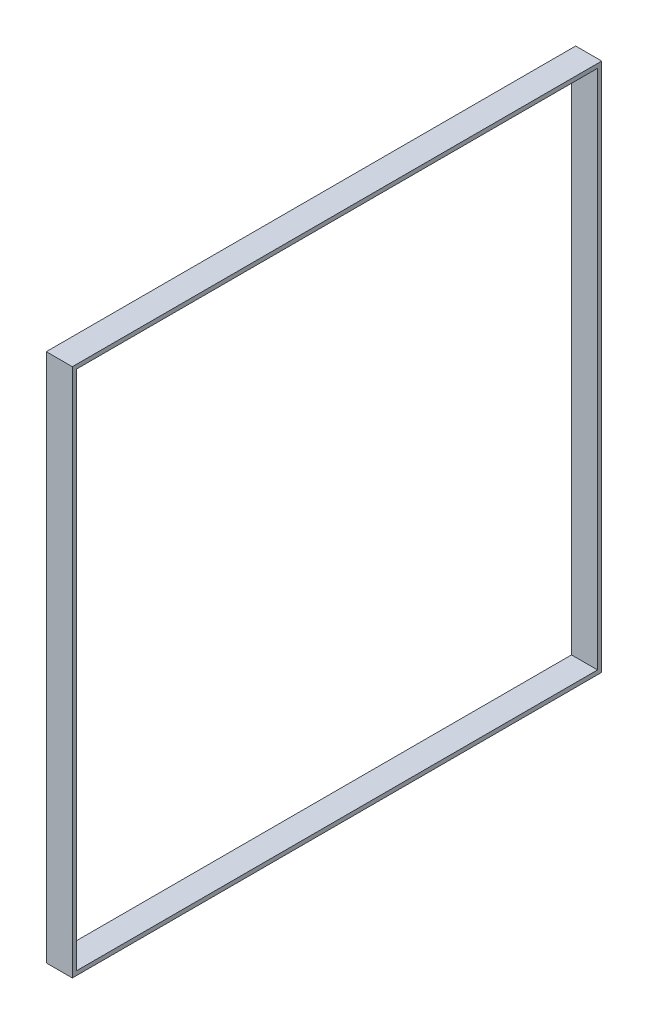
SolidWorks part; units mm, degrees
ref_plane "Front Plane" through (0, 0, 0) normal (1, 0, 0) x (0, 1, 0)
ref_plane "Top Plane" through (0, 0, 0) normal (0, 0, 1) x (0, 1, 0)
ref_plane "Right Plane" through (0, 0, 0) normal (0, 1, 0) x (-1, 0, 0)
sketch "Sketch1" plane through (0, 0, 0) normal (1, 0, 0) x (0, 1, 0)
  line L0 (-152.4, -152.4) -> (152.4, -152.4)
  line L1 (152.4, -152.4) -> (152.4, 152.4)
  line L2 (152.4, 152.4) -> (-152.4, 152.4)
  line L3 (-152.4, 152.4) -> (-152.4, -152.4)
  line L4 (-150, -150) -> (150, -150)
  line L5 (150, -150) -> (150, 150)
  line L6 (150, 150) -> (-150, 150)
  line L7 (-150, 150) -> (-150, -150)
extrude "Perimeter_seal" add sketch "Sketch1" along normal blind 15
